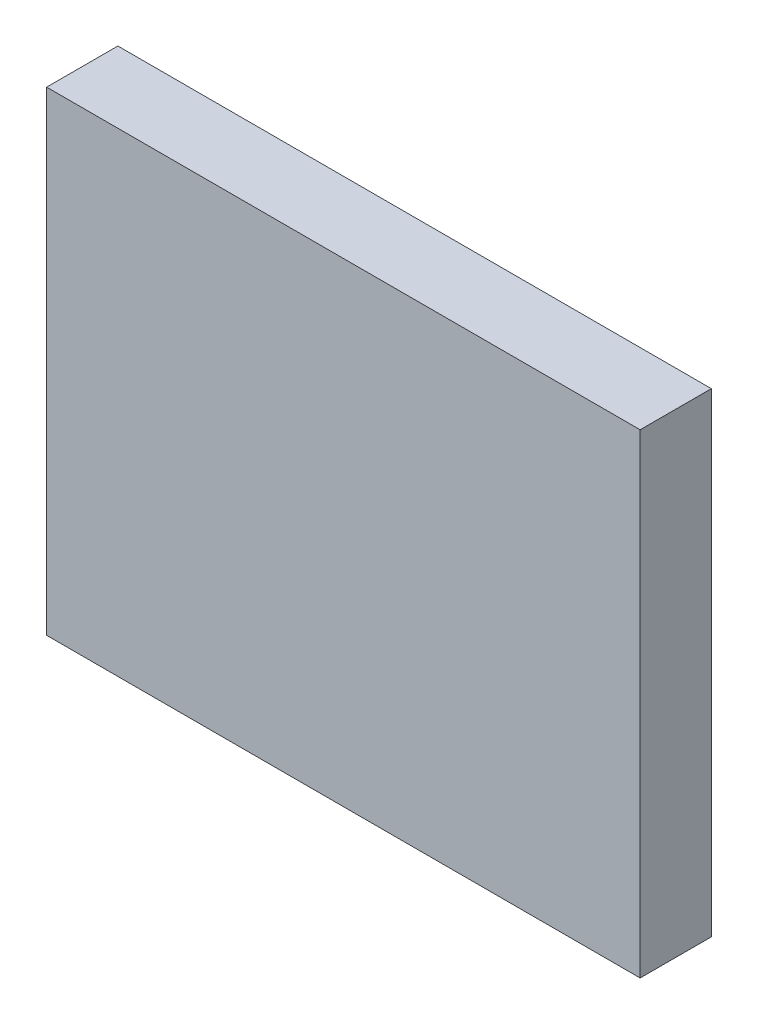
SolidWorks part; units mm, degrees
ref_plane "前视基准面" through (0, 0, 0) normal (0, 0, 1) x (1, 0, 0)
ref_plane "上视基准面" through (0, 0, 0) normal (0, 1, 0) x (1, 0, 0)
ref_plane "右视基准面" through (0, 0, 0) normal (1, 0, 0) x (0, 0, -1)
sketch "草图1" plane through (0, 0, 0) normal (0, 0, 1) x (1, 0, 0)
  line L1 (0, 0) -> (50, 0)
  line L2 (0, 0) -> (0, 40)
  line L3 (0, 40) -> (50, 40)
  line L4 (50, 0) -> (50, 40)
  dimension "D1" = 40
  dimension "D2" = 50
extrude "拉伸2" add sketch "草图1" along normal blind 6
